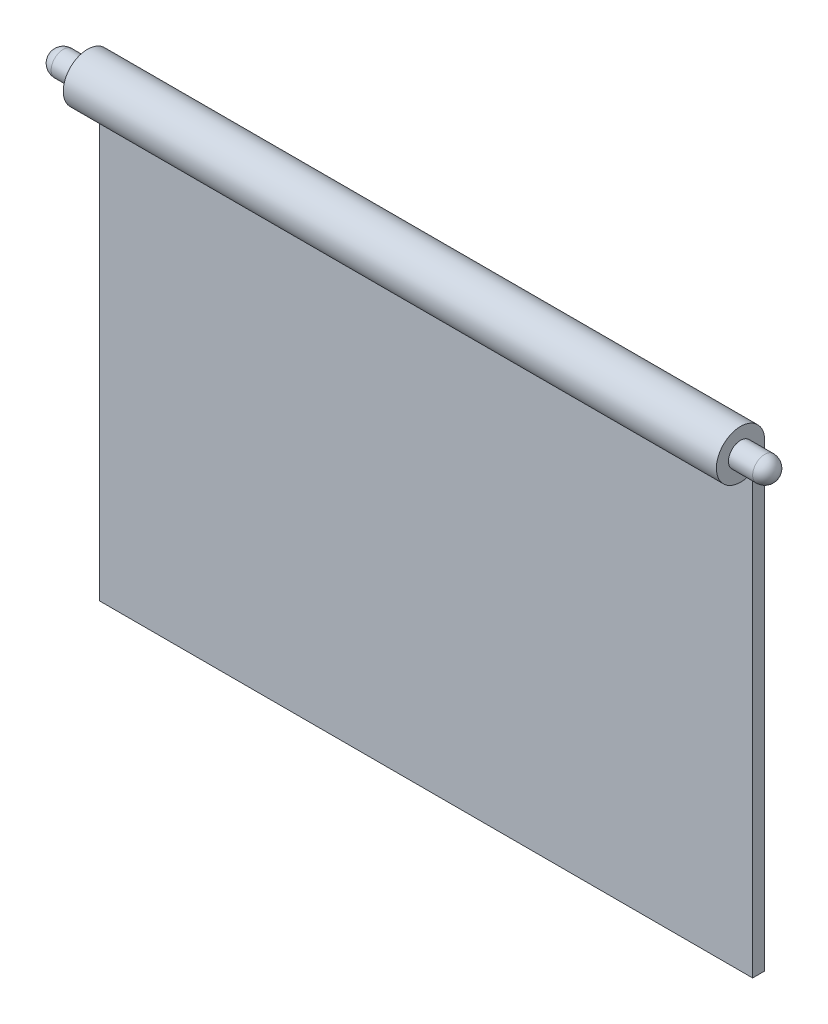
SolidWorks part; units mm, degrees
ref_plane "Vorderansicht (XY)" through (0, 0, 0) normal (0, 0, 1) x (1, 0, 0)
ref_plane "Draufansicht (XZ)" through (0, 0, 0) normal (0, 1, 0) x (1, 0, 0)
ref_plane "Seitenansicht (ZY)" through (0, 0, 0) normal (1, 0, 0) x (0, 0, -1)
sketch "Skizze1" plane through (0, 0, 0) normal (1, 0, 0) x (0, 0, -1)
  line L0 (5, -8.6603) -> (5, -190)
  line L1 (5, -190) -> (10, -190)
  line L2 (10, -190) -> (10, 0)
  arc A0 (10, 0) -> (5, -8.6603) centre (0, 0) ccw
  dimension "D1" = 10
  dimension "D2" = 5
  dimension "D3" = 190
extrude "Aufsatz-Linear austragen1" add sketch "Skizze1" along normal mid plane 270
sketch "Skizze2" plane through (135, 0, 0) normal (1, 0, 0) x (0, 0, -1)
  circle A0 centre (0, 0) radius 5
  dimension "D1" = 10
extrude "Aufsatz-Linear austragen2" add sketch "Skizze2" along normal blind 15
fillet "Verrundung1" radius 5 1 edges at (150, 0, -5)
mirror "Spiegeln1" about plane through (0, 0, 0) normal (1, 0, 0) of "Verrundung1", "Aufsatz-Linear austragen2"
ref_plane "Ebene1" through (0, -90, 0) normal (0, -1, 0) x (-1, 0, 0)
ref_plane "Plane1" through (0, 0, 0) normal (1, 0, 0) x (0, 0, -1)
sketch "Sketch2" plane through (0, 0, -10) normal (0, 0, -1) x (-1, 0, 0)
  line L0 (0, 0) -> (0, -20) construction
  line L1 (0, 33.9929) -> (0, -33.9929) construction
  line L2 (-10, -20) -> (10, -20)
  line L3 (10, -20) -> (7.5, -22.5)
  line L4 (7.5, -22.5) -> (-7.5, -22.5)
  line L5 (-7.5, -22.5) -> (-10, -20)
  point P8 (0, -20)
  dimension "D1" = 15
  dimension "D2" = 20
  dimension "D3" = 45
  dimension "D4" = 45
  dimension "D5" = 20
sketch "Sketch3" plane through (0, 0, 0) normal (1, 0, 0) x (0, 0, -1)
  line L0 (10, -20) -> (40, -40)
  line L1 (40, -40) -> (40, -150)
  line L2 (40, -150) -> (10, -170)
  dimension "D1" = 110
  dimension "D2" = 20
  dimension "D3" = 20
  dimension "D4" = 30
  dimension "D5" = 30
sweep "Sweep1" add profiles "Sketch2" path "Sketch3"
